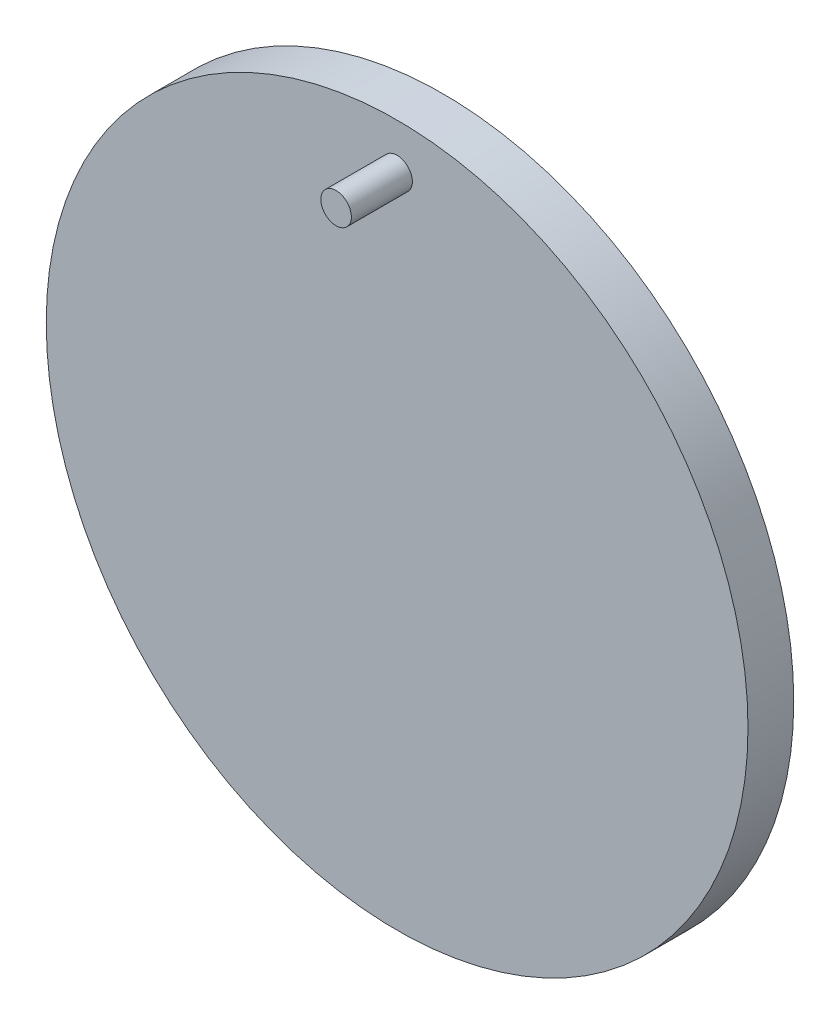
SolidWorks part; units mm, degrees
ref_plane "Front Plane" through (0, 0, 0) normal (0, 0, 1) x (1, 0, 0)
ref_plane "Top Plane" through (0, 0, 0) normal (0, 1, 0) x (1, 0, 0)
ref_plane "Right Plane" through (0, 0, 0) normal (1, 0, 0) x (0, 0, -1)
sketch "Sketch1" plane through (0, 0, 0) normal (0, 0, 1) x (1, 0, 0)
  circle A0 centre (0, 0) radius 100 construction
  circle A1 centre (0, 0) radius 115
  circle A2 centre (0, 0) radius 85 construction
  dimension "D1" = 200
  dimension "D2" = 15
  dimension "D3" = 15
extrude "Extrude1" add sketch "Sketch1" against normal blind 15
sketch "Sketch2" plane through (0, 0, 0) normal (0, 0, 1) x (1, 0, 0)
  circle A0 centre (0, 0) radius 100 construction
  circle A1 centre (0, 0) radius 100 construction
  circle A2 centre (0, 100) radius 5
  dimension "D1" = 10
extrude "Extrude2" add sketch "Sketch2" along normal blind 20
